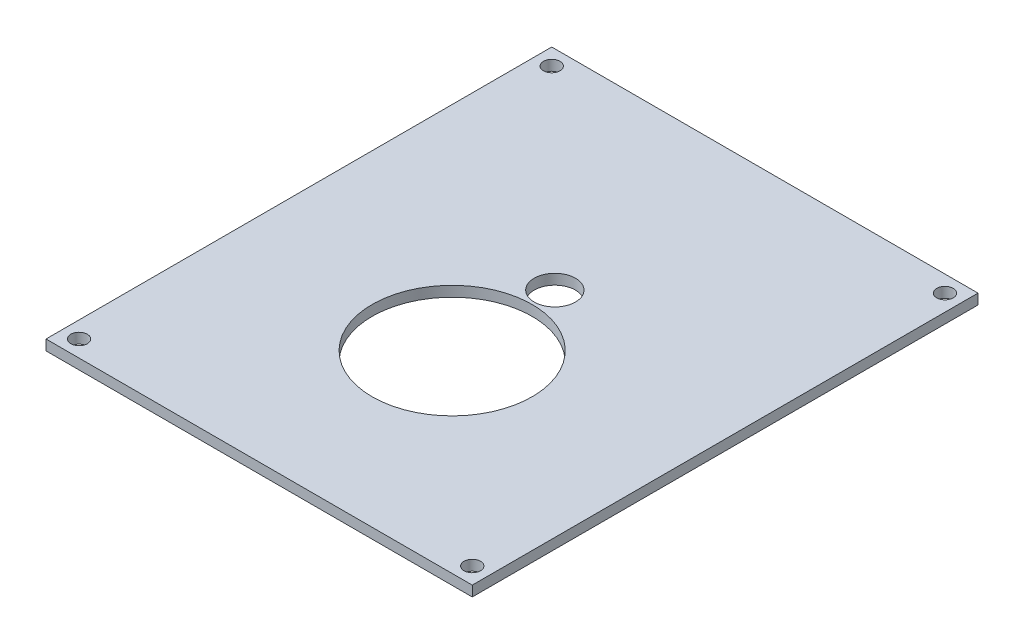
SolidWorks part; units mm, degrees
ref_plane "Front Plane" through (0, 0, 0) normal (0, 0, 1) x (1, 0, 0)
ref_plane "Top Plane" through (0, 0, 0) normal (0, 1, 0) x (1, 0, 0)
ref_plane "Right Plane" through (0, 0, 0) normal (1, 0, 0) x (0, 0, -1)
sketch "Sketch1" plane through (0, 0, 0) normal (0, 1, 0) x (1, 0, 0)
  line L1 (41.3, 49) -> (-41.3, 49)
  line L2 (41.3, 49) -> (41.3, -49)
  line L3 (41.3, -49) -> (-41.3, -49)
  line L4 (-41.3, 49) -> (-41.3, -49)
  line L5 (41.3, 49) -> (-41.3, -49) construction
  line L6 (41.3, -49) -> (-41.3, 49) construction
  point P0 (0, 0)
  dimension "D1" = 82.6
  dimension "D2" = 98
extrude "Boss-Extrude1" add sketch "Sketch1" along normal blind 2
hole_wizard "Ø3.2 (3.2) Diameter Hole1" positions "Sketch3" profile "Sketch2" hole size "Ø3.2" standard "ISO"
sketch "Sketch3" plane through (0, 2, 0) normal (0, 1, 0) x (1, 0, 0)
  line L0 (-41.3, 49) -> (-41.3, -49) construction
  line L1 (41.3, 49) -> (-41.3, 49) construction
  line L2 (41.3, -49) -> (41.3, 49) construction
  line L3 (-41.3, -49) -> (41.3, -49) construction
  point P0 (-38.1, 45.8)
  point P2 (38.1, 45.8)
  point P4 (38.1, -45.8)
  point P6 (-38.1, -45.8)
  dimension "D1" = 3.2
  dimension "D2" = 3.2
  dimension "D3" = 3.2
  dimension "D4" = 3.2
  dimension "D5" = 3.2
  dimension "D6" = 3.2
  dimension "D7" = 3.2
  dimension "D8" = 3.2
sketch "Sketch2" plane through (-38.1, 2, -45.8) normal (1, 0, 0) x (0, 0, 1)
  line L0 (0, 0) -> (0, 2)
  line L1 (0, 2) -> (1.6, 2)
  line L2 (1.6, 2) -> (1.6, 0)
  line L5 (1.6, 0) -> (0, 0)
  line L11 (0, -6.35) -> (0, 107.95) construction
  dimension "Thru Hole Dia." = 3.2
  dimension "Thru Hole Depth" = 2
sketch "Sketch4" plane through (0, 2, 0) normal (0, 1, 0) x (1, 0, 0)
  line L0 (-41.3, -49) -> (41.3, -49) construction
  circle A1 centre (0, -11.6) radius 15.5
  dimension "D2" = 31
  dimension "D3" = 37.4
extrude "Cut-Extrude1" cut sketch "Sketch4" against normal blind 2
sketch "Sketch5" plane through (0, 0, 0) normal (0, -1, 0) x (1, 0, 0)
  line L0 (41.3, 49) -> (41.3, -49) construction
  circle A0 centre (-0.2, -8.5) radius 4
  dimension "D1" = 8
  dimension "D2" = 41.5
  dimension "D3" = 8.5
extrude "Cut-Extrude2" cut sketch "Sketch5" against normal blind 10
